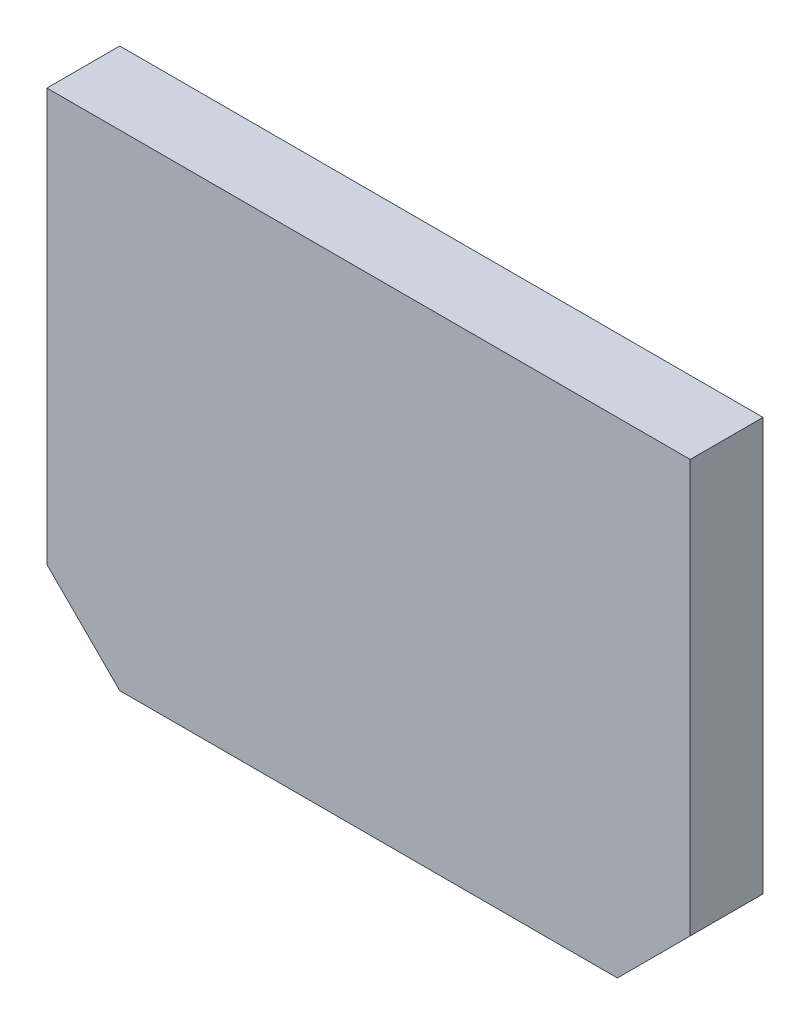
SolidWorks part; units mm, degrees
ref_plane "前视基准面" through (0, 0, 0) normal (0, 0, 1) x (1, 0, 0)
ref_plane "上视基准面" through (0, 0, 0) normal (0, 1, 0) x (1, 0, 0)
ref_plane "右视基准面" through (0, 0, 0) normal (1, 0, 0) x (0, 0, -1)
sketch "草图1" plane through (0, 0, 0) normal (0, 0, 1) x (1, 0, 0)
  line L1 (0, 0) -> (53, 0)
  line L2 (0, 0) -> (0, 40)
  line L3 (0, 40) -> (53, 40)
  line L4 (53, 0) -> (53, 40)
  dimension "D1" = 53
  dimension "D2" = 40
extrude "拉伸1" add sketch "草图1" along normal blind 6
chamfer "倒角1" distance 6 angle 45 2 edges at (53, 0, 3) (0, 0, 3)
